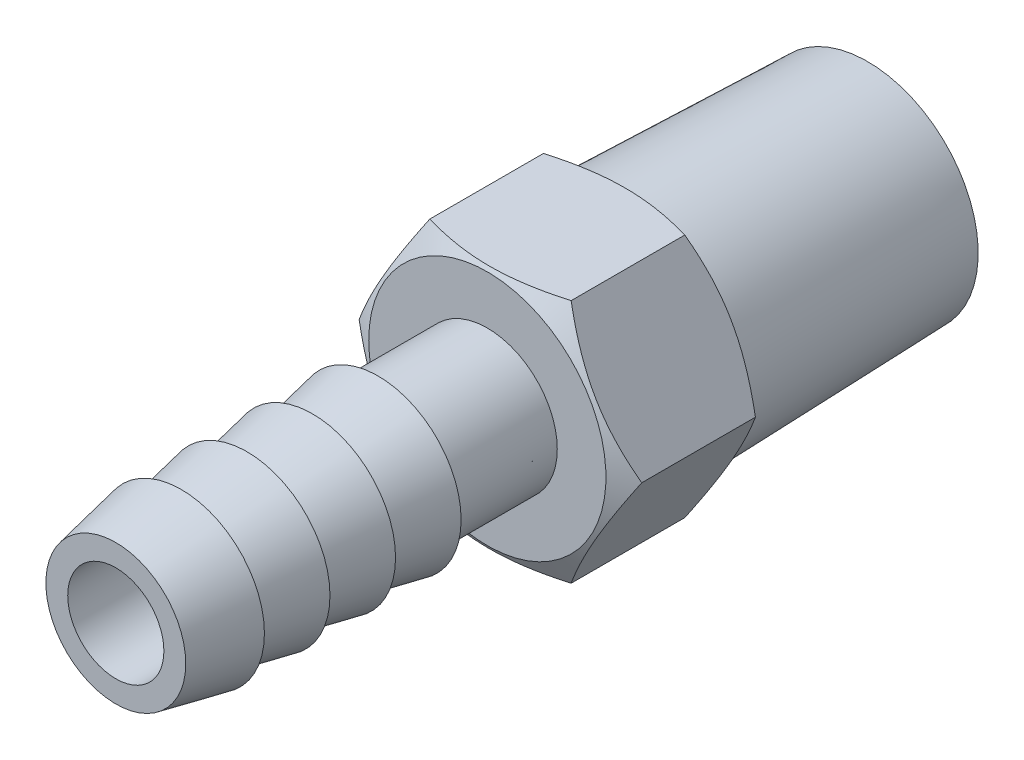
SolidWorks part; units mm, degrees
extrude "Base-Extrude" add sketch "Sketch1" along normal blind 8.128
sketch "Sketch1" plane through (0, 0, 0) normal (0, 0, 1) x (1, 0, 0)
  line L1 (8.2122, 0) -> (4.1061, 7.112)
  line L2 (4.1061, 7.112) -> (-4.1061, 7.112)
  line L3 (-4.1061, 7.112) -> (-8.2122, 0)
  line L4 (-8.2122, 0) -> (-4.1061, -7.112)
  line L5 (-4.1061, -7.112) -> (4.1061, -7.112)
  line L6 (4.1061, -7.112) -> (8.2122, 0)
  circle A0 centre (0, 0) radius 7.112 construction
  dimension "D1" = 14.224
ref_plane "Front" through (0, 0, 0) normal (0, 0, 1) x (1, 0, 0)
ref_plane "Top" through (0, 0, 0) normal (0, 1, 0) x (1, 0, 0)
ref_plane "Right" through (0, 0, 0) normal (1, 0, 0) x (0, 0, -1)
sketch "Sketch2" plane through (0, 0, 0) normal (0, 1, 0) x (1, 0, 0)
  line L0 (6.1127, -8.5782) -> (8.2122, -7.366)
  line L1 (8.2122, -8.128) -> (8.2122, 0) construction
  line L2 (8.2122, -0.762) -> (6.1127, 0.4502)
  line L3 (8.2122, -7.366) -> (8.2122, -0.762)
  line L4 (8.2122, -8.128) -> (4.1061, -8.128) construction
  line L5 (6.1127, -8.5782) -> (11.1927, -8.5782)
  line L6 (11.1927, -8.5782) -> (11.1927, 0.4502)
  line L7 (11.1927, 0.4502) -> (6.1127, 0.4502)
  line L8 (0, 0) -> (0, -3.7023) construction
  line L9 (8.2122, 0) -> (4.1061, 0) construction
  line L10 (8.2122, -8.128) -> (8.2122, 0) construction
revolve "Cut-Revolve1" cut sketch "Sketch2" angle 360 about L8
sketch "Sketch3" plane through (0, 0, 0) normal (0, 1, 0) x (1, 0, 0)
  line L1 (6.858, 0) -> (2.794, 0)
  line L2 (6.858, 0) -> (6.4239, 13.97)
  line L3 (0, 0) -> (0, -4.2758) construction
  line L4 (2.794, 13.97) -> (2.794, 0)
  line L5 (2.794, 13.97) -> (6.4239, 13.97)
  line L6 (6.8924, 0) -> (-6.8924, 0) construction
  dimension "D1" = 6.858
  dimension "D2" = 88.22
  dimension "D3" = 5.588
  dimension "D4" = 13.97
revolve "Boss-Revolve1" add sketch "Sketch3" angle 360 about L3
sketch "Sketch4" plane through (0, 0, 8.128) normal (0, 0, 1) x (1, 0, 0)
  circle A0 centre (0, 0) radius 2.794 construction
  circle A1 centre (0, 0) radius 2.794
extrude "Cut-Extrude1" cut sketch "Sketch4" against normal through all
sketch "Sketch5" plane through (0, 0, 0) normal (0, 1, 0) x (1, 0, 0)
  line L0 (2.794, -29.718) -> (4.064, -29.718)
  line L1 (4.064, -29.718) -> (4.826, -25.908)
  line L2 (2.794, -8.128) -> (2.794, -29.718)
  line L3 (4.826, -25.908) -> (4.064, -25.908)
  line L4 (4.064, -25.908) -> (4.826, -22.098)
  line L5 (4.826, -22.098) -> (4.064, -22.098)
  line L6 (0, 0) -> (0, 6.2756) construction
  line L7 (0, -8.128) -> (0, 13.97) construction
  line L8 (4.064, -22.098) -> (4.826, -18.288)
  line L9 (4.826, -18.288) -> (4.064, -18.288)
  line L10 (4.064, -18.288) -> (4.826, -14.478)
  line L11 (4.826, -14.478) -> (4.064, -14.478)
  line L15 (4.064, -14.478) -> (4.064, -8.128)
  line L16 (2.794, -8.128) -> (4.064, -8.128)
  line L17 (-6.8924, -8.128) -> (6.8924, -8.128) construction
  line L18 (2.794, -8.128) -> (2.794, 13.97) construction
  dimension "D1" = 1.27
  dimension "D2" = 21.59
  dimension "D3" = 3.81
  dimension "D4" = 9.652
revolve "Boss-Revolve2" add sketch "Sketch5" angle 360 about L6
equation "\"D2@Sketch2\" = \"D1@Sketch2\""
